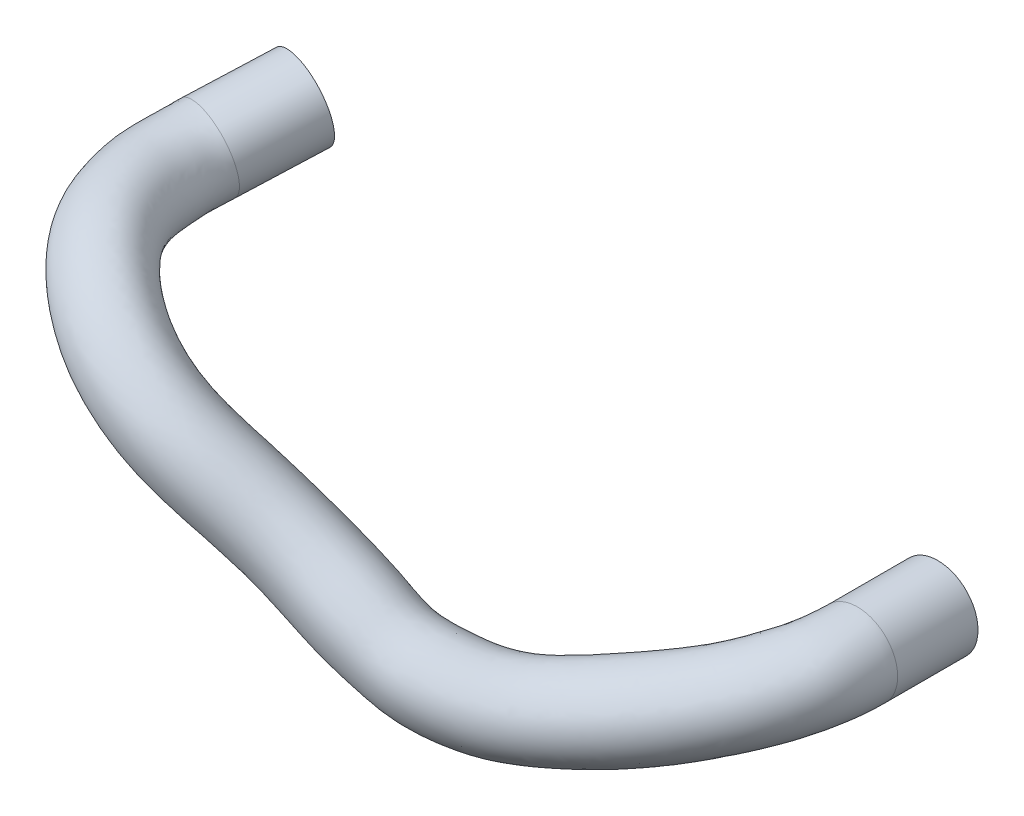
SolidWorks part; units mm, degrees
ref_plane "Front" through (0, 0, 0) normal (0, 0, 1) x (1, 0, 0)
ref_plane "Top" through (0, 0, 0) normal (0, 1, 0) x (1, 0, 0)
ref_plane "Right" through (0, 0, 0) normal (1, 0, 0) x (0, 0, -1)
sketch3d "3DSketch1"
  line L0 (0, 13.5636, 12.7) -> (0, 13.5636, 0)
  line L1 (-94.2791, 39.7528, 21.0147) -> (-91.4015, 42.0621, 8.8625)
  circle A0 centre (-91.4015, 42.0621, 8.8625) radius 5.9055 construction
  circle A3 centre (0, 13.5636, 0) radius 6.35 construction
  spline_without_curve S0
  point P9 (0, 13.5636, 6.35)
  point P16 (-90.0635, 43.136, 3.2117)
  dimension "D1" = 12.7
  dimension "D2" = 12.7
sketch "Sketch2" plane through (0, 0, 0) normal (0, 0, 1) x (1, 0, 0)
  circle A0 centre (0, 13.5636) radius 6.35 construction
  circle A1 centre (0, 13.5636) radius 6.35
sweep "Base-Sweep" add profiles "Sketch2" path "3DSketch1"
